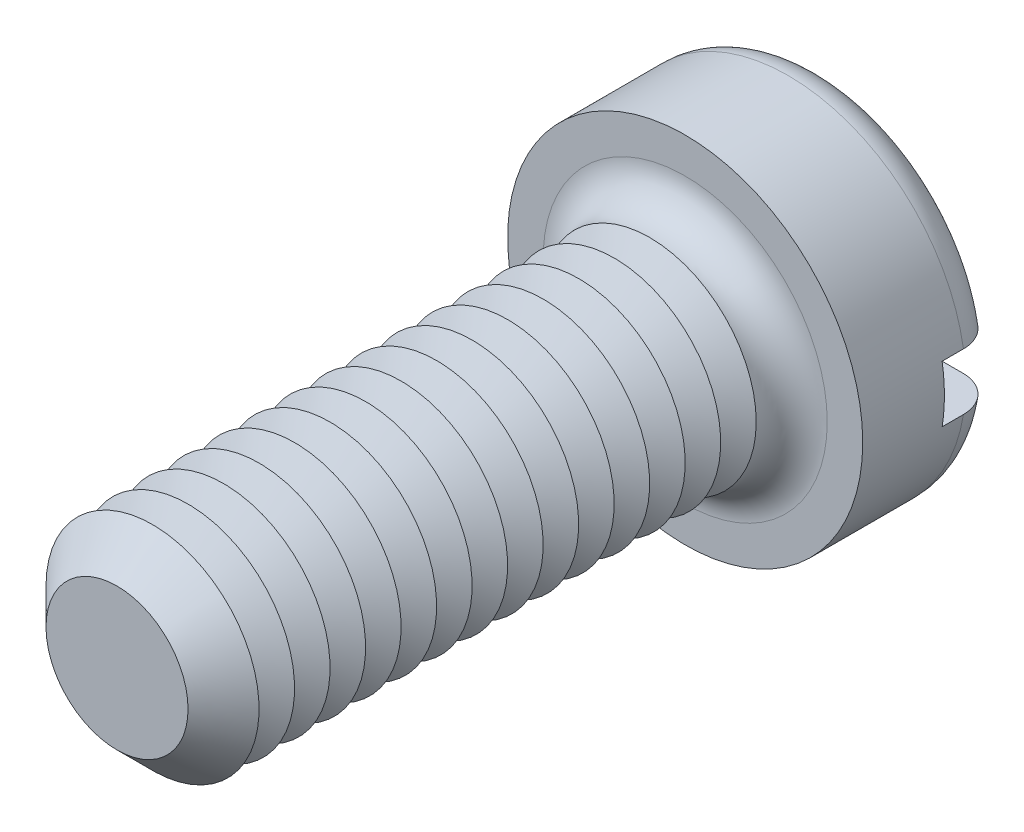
SolidWorks part; units mm, degrees
ref_plane "Front Plane" through (0, 0, 0) normal (0, 0, 1) x (1, 0, 0)
ref_plane "Top Plane" through (0, 0, 0) normal (0, 1, 0) x (1, 0, 0)
ref_plane "Right Plane" through (0, 0, 0) normal (1, 0, 0) x (0, 0, -1)
sketch "Sketch3" plane through (0, 0, 0) normal (0, 0, 1) x (1, 0, 0)
  circle A0 centre (0, 0) radius 5
  dimension "D1" = 10
extrude "Boss-Extrude2" add sketch "Sketch3" against normal blind 3.9
sketch "Sketch4" plane through (0, 0, 0) normal (0, 0, 1) x (1, 0, 0)
  circle A0 centre (0, 0) radius 3
  dimension "D1" = 6
extrude "Boss-Extrude3" add sketch "Sketch4" along normal blind 16
fillet "Fillet1" radius 1 2 edges at (5, 0, -3.9) (3, 0, 0)
chamfer "Chamfer1" distance 1 angle 45 1 edges at (3, 0, 16)
sketch "Sketch5" plane through (0, 0, 0) normal (1, 0, 0) x (0, 0, -1)
  line L0 (1.6944, 0) -> (-7.6738, 0) construction
sketch "Sketch6" plane through (0, 0, 0) normal (1, 0, 0) x (0, 0, -1)
  line L0 (-1, 3) -> (-1.5, 2.134)
  line L1 (-1.5, 2.134) -> (-2, 3)
  line L2 (-1, 3) -> (-15, 3) construction
  line L3 (-2, 3) -> (-1, 3)
  dimension "D1" = 1
revolve "Cut-Revolve1" cut sketch "Sketch6" angle 360 about L0
pattern_linear "LPattern1" count 14 spacing 1 along (0, 0, 1) of "Cut-Revolve1"
sketch "Sketch8" plane through (0, 0, -3.9) normal (0, 0, -1) x (-1, 0, 0)
  line L1 (5, -0.8) -> (-5, -0.8)
  line L2 (5, -0.8) -> (5, 0.8)
  line L3 (5, 0.8) -> (-5, 0.8)
  line L4 (-5, -0.8) -> (-5, 0.8)
  line L5 (5, -0.8) -> (-5, 0.8) construction
  line L6 (5, 0.8) -> (-5, -0.8) construction
  point P0 (0, 0)
  dimension "D1" = 10
  dimension "D2" = 1.6
extrude "Cut-Extrude1" cut sketch "Sketch8" against normal blind 1.6
